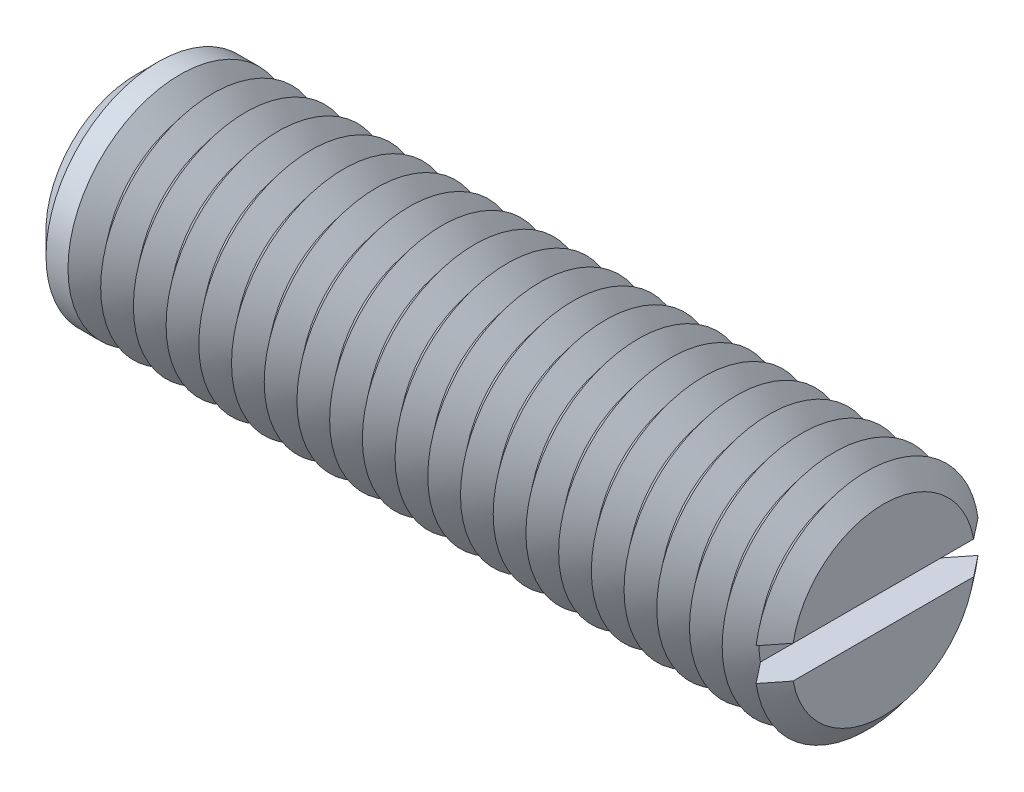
SolidWorks part; units mm, degrees
ref_plane "Front Plane" through (0, 0, 0) normal (0, 0, 1) x (1, 0, 0)
ref_plane "Top Plane" through (0, 0, 0) normal (0, 1, 0) x (1, 0, 0)
ref_plane "Right Plane" through (0, 0, 0) normal (1, 0, 0) x (0, 0, -1)
sketch "Sketch1" plane through (0, 0, 0) normal (1, 0, 0) x (0, 0, -1)
  circle A0 centre (0, 0) radius 6
  dimension "D1" = 12
extrude "Extrude1" add sketch "Sketch1" along normal mid plane 40
sketch "Sketch2" plane through (0, 0, 0) normal (0, 0, 1) x (1, 0, 0)
  line L0 (20, 0.875) -> (18.25, 0.875)
  line L1 (20, -6) -> (20, 6) construction
  line L2 (18.25, 0.875) -> (18.25, -0.875)
  line L3 (0, 0) -> (50000, 0) construction
  line L4 (20, -0.875) -> (18.25, -0.875)
  line L5 (20, -0.875) -> (20, 0.875)
  point P9 (18.25, 0)
  dimension "D1" = 1.75
extrude "Extrude2" cut sketch "Sketch2" against normal mid plane 18
chamfer "Chamfer1" distance 1.2 angle 45 1 edges at (-20, 0, -6)
sketch "Sketch3" plane through (0, 0, 0) normal (0, 0, 1) x (1, 0, 0)
  line L0 (0, 0) -> (30.9602, 0) construction
  line L1 (19.125, -6) -> (20.875, -6)
  line L2 (-18.8, -6) -> (20, -6) construction
  line L3 (20.875, -6) -> (20, -4.9071)
  line L4 (20, -6) -> (20, -0.875) construction
  line L5 (20, -4.9071) -> (19.125, -6)
  dimension "D1" = 1.75
  dimension "D2" = 1.4
revolve "Cut-Revolve1" cut sketch "Sketch3" angle 360 about L0
pattern_linear "LPattern1" count 22 spacing 1.75 along (-1, 0, 0) of "Cut-Revolve1"
equation "\"D2@Sketch3\" = \"D1@Sketch3\"*0.8"
